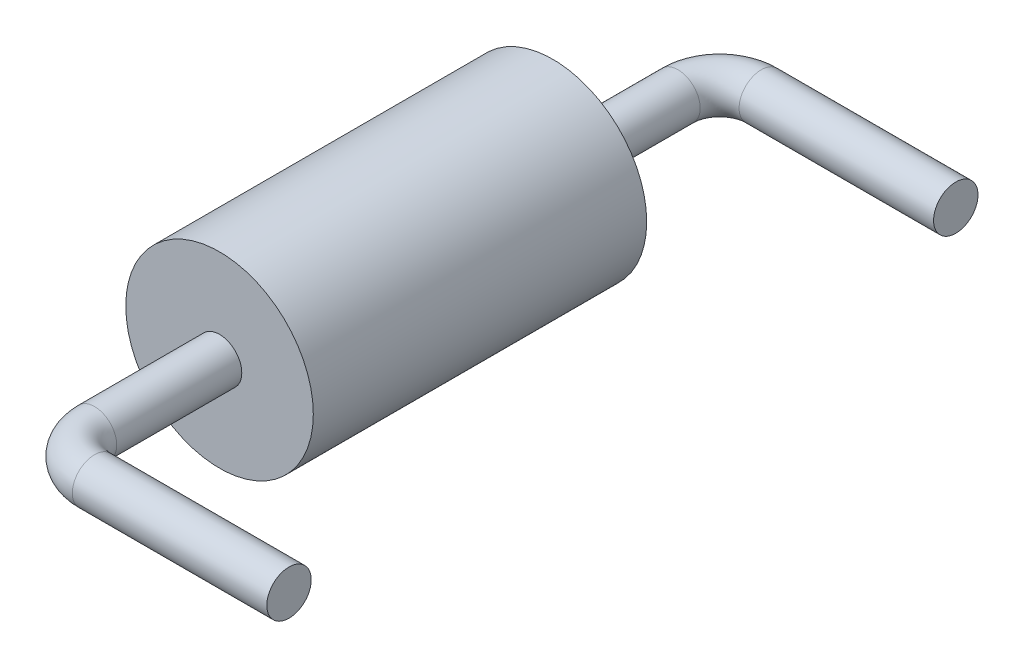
SolidWorks part; units mm, degrees
ref_plane "前视基准面" through (0, 0, 0) normal (0, 0, 1) x (1, 0, 0)
ref_plane "上视基准面" through (0, 0, 0) normal (0, 1, 0) x (1, 0, 0)
ref_plane "右视基准面" through (0, 0, 0) normal (1, 0, 0) x (0, 0, -1)
sketch "Sketch2" plane through (0, 0, 0) normal (0, 0, 1) x (1, 0, 0)
  circle A0 centre (0, 0) radius 1.35
  dimension "D1" = 2.7
extrude "Boss-Extrude2" add sketch "Sketch2" along normal blind 4.8
sketch "Sketch3" plane through (0, 0, 0) normal (0, 1, 0) x (1, 0, 0)
  line L0 (0, 0) -> (0, 1.8)
  line L1 (0.6, 2.4) -> (3.4, 2.4)
  line L2 (-1.35, -2.4) -> (3.8962, -2.4) construction
  line L3 (-1.35, 0) -> (-1.35, -4.8) construction
  line L4 (0, -4.8) -> (0, -6.6)
  line L5 (0.6, -7.2) -> (3.4, -7.2)
  arc A0 (0, 1.8) -> (0.6, 2.4) centre (0.6, 1.8) cw
  arc A1 (0, -6.6) -> (0.6, -7.2) centre (0.6, -6.6) ccw
  point P8 (0, 0)
  point P9 (0, 0)
  dimension "D1" = 0.6
sketch "Sketch4" plane through (0, 0, 0) normal (0, 0, -1) x (-1, 0, 0)
  circle A0 centre (0, 0) radius 0.32
sweep "Sweep1" add profiles "Sketch4" path "Sketch3"
ref_plane "Plane1" through (0, 0, 2.4) normal (0, 0, 1) x (1, 0, 0)
mirror "Mirror1" about plane through (0, 0, 2.4) normal (0, 0, 1) of "Sweep1"
